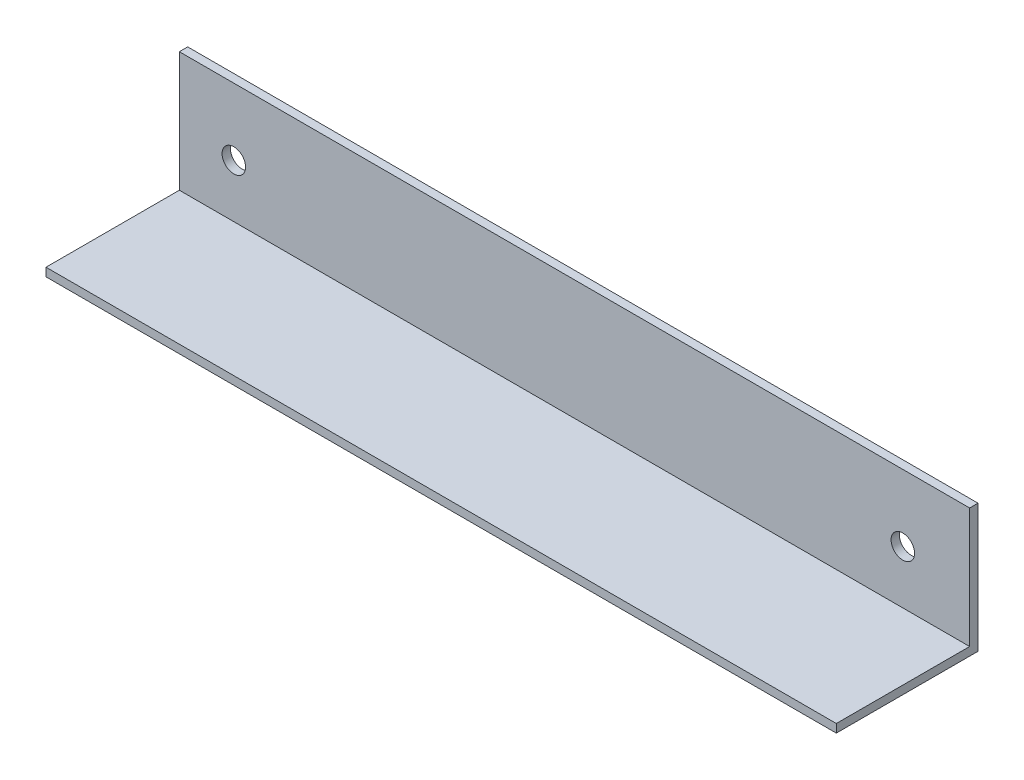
SolidWorks part; units mm, degrees
ref_plane "Front" through (0, 0, 0) normal (0, 0, 1) x (1, 0, 0)
ref_plane "Top" through (0, 0, 0) normal (0, 1, 0) x (1, 0, 0)
ref_plane "Right" through (0, 0, 0) normal (1, 0, 0) x (0, 0, -1)
sketch "Sketch1" plane through (0, 0, 0) normal (0, 0, 1) x (1, 0, 0)
  line L1 (-209.8261, 67.8385) -> (196.5739, 67.8385)
  line L2 (-209.8261, 67.8385) -> (-209.8261, 43.4545)
  line L3 (-209.8261, 43.4545) -> (196.5739, 43.4545)
  line L4 (196.5739, 67.8385) -> (196.5739, 43.4545)
  dimension "D1" = 406.4
  dimension "D2" = 24.384
extrude "Boss-Extrude1" add sketch "Sketch1" along normal blind 26.924
sketch "Sketch2" plane through (0, 67.8385, 0) normal (0, 1, 0) x (1, 0, 0)
  line L0 (-209.8261, -26.924) -> (-209.8261, 0) construction
  line L1 (-209.8261, -1.5875) -> (196.5739, -1.5875)
  line L2 (-209.8261, -1.5875) -> (-209.8261, -26.924)
  line L3 (-209.8261, -26.924) -> (196.5739, -26.924)
  line L4 (196.5739, -1.5875) -> (196.5739, -26.924)
  line L5 (196.5739, 0) -> (-209.8261, 0) construction
  dimension "D1" = 1.5875
extrude "Cut-Extrude1" cut sketch "Sketch2" against normal blind 12.7
sketch "Sketch3" plane through (0, 0, 26.924) normal (0, 0, 1) x (1, 0, 0)
  line L0 (196.5739, 43.4545) -> (196.5739, 55.1385) construction
  line L1 (-209.8261, 55.1385) -> (196.5739, 55.1385)
  line L2 (-209.8261, 55.1385) -> (-209.8261, 45.042)
  line L3 (-209.8261, 45.042) -> (196.5739, 45.042)
  line L4 (196.5739, 55.1385) -> (196.5739, 45.042)
  line L5 (-209.8261, 43.4545) -> (196.5739, 43.4545) construction
  dimension "D1" = 1.5875
extrude "Cut-Extrude3" cut sketch "Sketch3" against normal up to surface (25.3365 mm away)
sketch "Sketch5" plane through (0, 0, 0) normal (0, 0, -1) x (-1, 0, 0)
  line L0 (6.6261, 77.4225) -> (6.6261, -19.794) construction
  line L1 (-196.5739, 67.8385) -> (209.8261, 67.8385) construction
  line L2 (-196.5739, 43.4545) -> (-196.5739, 67.8385) construction
  circle A0 centre (-183.8739, 55.1385) radius 2.2339
  circle A1 centre (197.1261, 55.1385) radius 2.2339
  circle A2 centre (-56.756, 55.1385) radius 2.2339
  point P12 (0, 0)
  point P13 (-47.1306, 55.1385)
  point P14 (-50.9444, 55.1385)
  point P15 (-56.756, 55.1385)
  dimension "D3" = 4.4679
  dimension "D1" = 12.7
  dimension "D2" = 12.7
extrude "Cut-Extrude5" cut sketch "Sketch5" against normal blind 2.54
sketch "Sketch6" plane through (0, 43.4545, 0) normal (0, -1, 0) x (1, 0, 0)
  line L1 (-240.9036, 83.7452) -> (46.4016, 83.7452)
  line L2 (-240.9036, 83.7452) -> (-240.9036, -85.6356)
  line L3 (-240.9036, -85.6356) -> (46.4016, -85.6356)
  line L4 (46.4016, 83.7452) -> (46.4016, -85.6356)
  point P4 (-5.0998, 88.0533)
  point P5 (80.279, 86.6825)
  point P6 (24.0778, 84.7243)
  point P7 (31.3232, 84.7243)
  point P8 (40.7227, 84.7243)
  point P9 (46.4016, 83.7452)
extrude "Cut-Extrude6" cut sketch "Sketch6" against normal blind 65.024
equation "\".5n\"=1"
